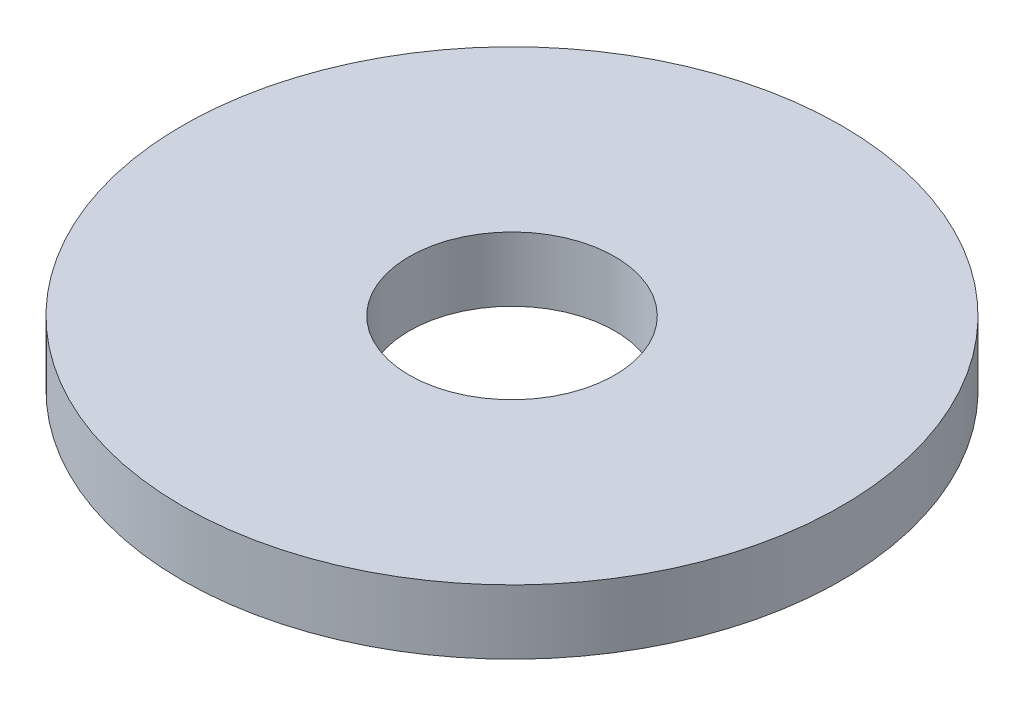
SolidWorks part; units mm, degrees
ref_plane "Front Plane" through (0, 0, 0) normal (0, 0, 1) x (1, 0, 0)
ref_plane "Top Plane" through (0, 0, 0) normal (0, 1, 0) x (1, 0, 0)
ref_plane "Right Plane" through (0, 0, 0) normal (1, 0, 0) x (0, 0, -1)
sketch "Sketch1" plane through (0, 0, 0) normal (0, 1, 0) x (1, 0, 0)
  circle A0 centre (0, 0) radius 2.5146
  circle A1 centre (0, 0) radius 8.0645
  dimension "D1" = 5.0292
  dimension "D2" = 16.129
extrude "Boss-Extrude1" add sketch "Sketch1" along normal blind 1.5748
